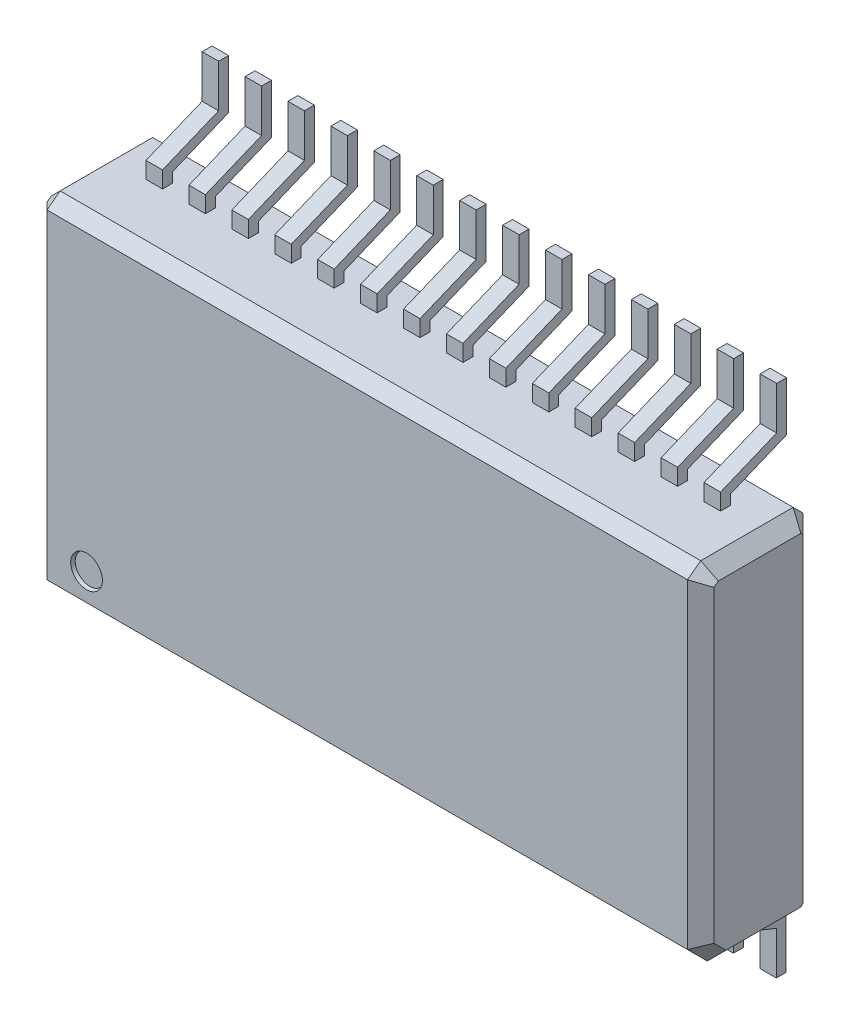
SolidWorks part; units mm, degrees
ref_plane "Plane1" through (0, 0, 0) normal (0, 0, 1) x (1, 0, 0)
ref_plane "Plane2" through (0, 0, 0) normal (0, 1, 0) x (1, 0, 0)
ref_plane "Plane3" through (0, 0, 0) normal (1, 0, 0) x (0, 0, -1)
sketch "Sketch1" plane through (0, 0, 0) normal (0, 0, 1) x (1, 0, 0)
  line L0 (1.35, 7.8) -> (1.35, 6.55)
  line L1 (0, 1.25) -> (0.695, 1.25)
  line L2 (0, 1.25) -> (0, 6.55)
  line L3 (1.6, 6.55) -> (1.6, 7.8)
  line L4 (1.6, 7.8) -> (1.35, 7.8)
  line L5 (1.595, 0) -> (1.345, 0)
  line L6 (1.595, 1.25) -> (1.595, 0)
  line L7 (1.345, 0) -> (1.345, 1.25)
  line L8 (1.595, 1.25) -> (1.995, 1.25)
  line L9 (2, 6.55) -> (1.6, 6.55)
  line L10 (2, 7.8) -> (2, 6.55)
  line L11 (2.25, 6.55) -> (2.25, 7.8)
  line L12 (2.25, 7.8) -> (2, 7.8)
  line L13 (2.245, 0) -> (1.995, 0)
  line L14 (2.245, 1.25) -> (2.245, 0)
  line L15 (1.995, 0) -> (1.995, 1.25)
  line L16 (2.245, 1.25) -> (2.645, 1.25)
  line L17 (2.65, 6.55) -> (2.25, 6.55)
  line L18 (2.65, 7.8) -> (2.65, 6.55)
  line L19 (2.9, 6.55) -> (2.9, 7.8)
  line L20 (2.9, 7.8) -> (2.65, 7.8)
  line L21 (2.895, 0) -> (2.645, 0)
  line L22 (2.895, 1.25) -> (2.895, 0)
  line L23 (2.645, 0) -> (2.645, 1.25)
  line L24 (2.895, 1.25) -> (3.295, 1.25)
  line L25 (3.3, 6.55) -> (2.9, 6.55)
  line L26 (3.3, 7.8) -> (3.3, 6.55)
  line L27 (3.55, 6.55) -> (3.55, 7.8)
  line L28 (3.55, 7.8) -> (3.3, 7.8)
  line L29 (3.545, 0) -> (3.295, 0)
  line L30 (3.545, 1.25) -> (3.545, 0)
  line L31 (3.295, 0) -> (3.295, 1.25)
  line L32 (3.545, 1.25) -> (3.945, 1.25)
  line L33 (3.95, 6.55) -> (3.55, 6.55)
  line L34 (3.95, 7.8) -> (3.95, 6.55)
  line L35 (0.7, 7.8) -> (0.7, 6.55)
  line L36 (0.95, 6.55) -> (0.95, 7.8)
  line L37 (0.95, 7.8) -> (0.7, 7.8)
  line L38 (0.945, 0) -> (0.695, 0)
  line L39 (0.945, 1.25) -> (0.945, 0)
  line L40 (0.695, 0) -> (0.695, 1.25)
  line L41 (4.2, 6.55) -> (4.2, 7.8)
  line L42 (4.2, 7.8) -> (3.95, 7.8)
  line L43 (4.195, 0) -> (3.945, 0)
  line L44 (4.195, 1.25) -> (4.195, 0)
  line L45 (3.945, 0) -> (3.945, 1.25)
  line L46 (4.195, 1.25) -> (4.595, 1.25)
  line L47 (4.6, 6.55) -> (4.2, 6.55)
  line L48 (4.6, 7.8) -> (4.6, 6.55)
  line L49 (4.85, 6.55) -> (4.85, 7.8)
  line L50 (4.85, 7.8) -> (4.6, 7.8)
  line L51 (4.845, 0) -> (4.595, 0)
  line L52 (4.845, 1.25) -> (4.845, 0)
  line L53 (4.595, 0) -> (4.595, 1.25)
  line L54 (4.845, 1.25) -> (5.245, 1.25)
  line L55 (5.25, 6.55) -> (4.85, 6.55)
  line L56 (5.25, 7.8) -> (5.25, 6.55)
  line L57 (5.5, 6.55) -> (5.5, 7.8)
  line L58 (5.5, 7.8) -> (5.25, 7.8)
  line L59 (5.495, 0) -> (5.245, 0)
  line L60 (5.495, 1.25) -> (5.495, 0)
  line L61 (5.245, 0) -> (5.245, 1.25)
  line L62 (5.495, 1.25) -> (5.895, 1.25)
  line L63 (5.9, 6.55) -> (5.5, 6.55)
  line L64 (5.9, 7.8) -> (5.9, 6.55)
  line L65 (6.15, 6.55) -> (6.15, 7.8)
  line L66 (6.15, 7.8) -> (5.9, 7.8)
  line L67 (6.145, 0) -> (5.895, 0)
  line L68 (0.945, 1.25) -> (1.345, 1.25)
  line L69 (6.145, 1.25) -> (6.145, 0)
  line L70 (5.895, 0) -> (5.895, 1.25)
  line L71 (6.145, 1.25) -> (6.545, 1.25)
  line L72 (6.55, 6.55) -> (6.15, 6.55)
  line L73 (6.55, 7.8) -> (6.55, 6.55)
  line L74 (6.8, 6.55) -> (6.8, 7.8)
  line L75 (6.8, 7.8) -> (6.55, 7.8)
  line L76 (6.795, 0) -> (6.545, 0)
  line L77 (6.795, 1.25) -> (6.795, 0)
  line L78 (0.7, 6.55) -> (0, 6.55)
  line L79 (1.35, 6.55) -> (0.95, 6.55)
  line L80 (6.545, 0) -> (6.545, 1.25)
  line L81 (6.795, 1.25) -> (7.195, 1.25)
  line L82 (7.2, 6.55) -> (6.8, 6.55)
  line L83 (7.2, 7.8) -> (7.2, 6.55)
  line L84 (7.45, 6.55) -> (7.45, 7.8)
  line L85 (7.45, 7.8) -> (7.2, 7.8)
  line L86 (7.445, 0) -> (7.195, 0)
  line L87 (7.445, 1.25) -> (7.445, 0)
  line L88 (7.195, 0) -> (7.195, 1.25)
  line L89 (7.445, 1.25) -> (7.845, 1.25)
  line L90 (7.85, 6.55) -> (7.45, 6.55)
  line L91 (7.85, 7.8) -> (7.85, 6.55)
  line L92 (8.1, 6.55) -> (8.1, 7.8)
  line L93 (8.1, 7.8) -> (7.85, 7.8)
  line L94 (8.095, 0) -> (7.845, 0)
  line L95 (8.095, 1.25) -> (8.095, 0)
  line L96 (7.845, 0) -> (7.845, 1.25)
  line L97 (8.095, 1.25) -> (8.495, 1.25)
  line L98 (8.5, 6.55) -> (8.1, 6.55)
  line L99 (8.5, 7.8) -> (8.5, 6.55)
  line L100 (8.75, 6.55) -> (8.75, 7.8)
  line L101 (8.75, 7.8) -> (8.5, 7.8)
  line L102 (8.745, 0) -> (8.495, 0)
  line L103 (8.745, 1.25) -> (8.745, 0)
  line L104 (8.495, 0) -> (8.495, 1.25)
  line L105 (8.745, 1.25) -> (9.145, 1.25)
  line L106 (9.15, 6.55) -> (8.75, 6.55)
  line L107 (9.15, 7.8) -> (9.15, 6.55)
  line L108 (9.4, 6.55) -> (9.4, 7.8)
  line L109 (9.4, 7.8) -> (9.15, 7.8)
  line L110 (9.395, 0) -> (9.145, 0)
  line L111 (10.1, 1.25) -> (10.1, 6.55)
  line L112 (9.395, 1.25) -> (9.395, 0)
  line L113 (9.145, 0) -> (9.145, 1.25)
  line L114 (9.395, 1.25) -> (10.1, 1.25)
  line L115 (10.1, 6.55) -> (9.4, 6.55)
  dimension "D1" = 10.1
  dimension "D2" = 7.8
  dimension "D3" = 5.3
  dimension "D4" = 1.25
  dimension "D5" = 1.25
  dimension "D6" = 1.25
  dimension "D7" = 1.25
  dimension "D8" = 0.25
  dimension "D9" = 0.25
  dimension "D10" = 0.65
  dimension "D11" = 0.65
  dimension "D12" = 0.7
  dimension "D13" = 0.695
  dimension "D14" = 0.7
extrude "Base-Extrude" add sketch "Sketch1" along normal blind 2
sketch "Sketch2" plane through (0, 0, 0) normal (1, 0, 0) x (0, 0, -1)
  line L0 (-0.25, 6.4) -> (-0.25, 1.4)
  line L1 (-2, 1.25) -> (-2, 6.55) construction
  line L3 (0, 7.8) -> (0, 7.05)
  line L4 (0, 6.55) -> (0, 7.8) construction
  line L6 (0, 7.05) -> (-0.85, 6.7)
  line L7 (-0.85, 6.7) -> (-0.85, 6.55)
  line L8 (-2, 6.55) -> (0, 6.55) construction
  line L9 (-0.25, 6.4) -> (-0.4, 6.55)
  line L11 (-0.4, 6.55) -> (-0.85, 6.55)
  line L12 (-2, 6.4) -> (-1.8, 6.55)
  line L13 (-1.8, 6.55) -> (-1, 6.55)
  line L14 (-1, 6.55) -> (-1, 6.8)
  line L15 (-1, 6.8) -> (-0.15, 7.15)
  line L17 (-0.15, 7.15) -> (-0.15, 7.8)
  line L18 (-2, 7.8) -> (0, 7.8) construction
  line L19 (-0.15, 7.8) -> (0, 7.8)
  line L21 (0, 0) -> (0, 0.75)
  line L22 (0, 0) -> (0, 1.25) construction
  line L23 (-1, 1.25) -> (-1, 1)
  line L24 (-2, 1.25) -> (0, 1.25) construction
  line L26 (-0.85, 1.25) -> (-0.85, 1.1)
  line L27 (-0.85, 1.1) -> (0, 0.75)
  line L28 (-1, 1) -> (-0.15, 0.65)
  line L29 (-0.15, 0.65) -> (-0.15, 0)
  line L30 (-2, 0) -> (0, 0) construction
  line L32 (-0.15, 0) -> (0, 0)
  line L33 (-0.85, 1.25) -> (-0.4, 1.25)
  line L34 (-0.4, 1.25) -> (-0.25, 1.4)
  line L35 (-1, 1.25) -> (-1.7, 1.25)
  line L36 (-1.7, 1.25) -> (-2, 1.55)
  line L37 (-2, 1.55) -> (-2, 6.4)
  dimension "D1" = 1.75
extrude "Cut-Extrude1" cut sketch "Sketch2" along normal blind 21.3 flip side to cut
chamfer "Chamfer1" distance 0.2 angle 45
sketch "Sketch3" plane through (0, 0, 2) normal (0, 0, 1) x (1, 0, 0)
  circle A0 centre (0.8, 1.96) radius 0.24
extrude "Cut-Extrude2" cut sketch "Sketch3" against normal blind 0.05 draft 20
